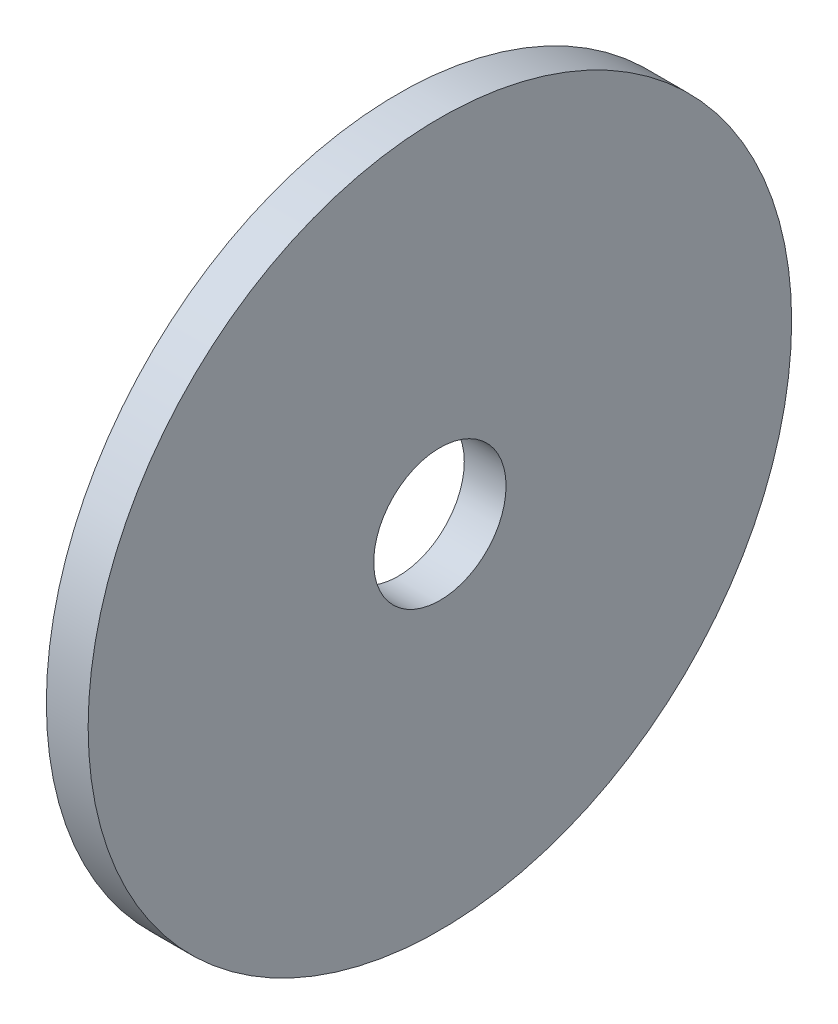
SolidWorks part; units mm, degrees
ref_plane "LAT. ESQUERDO" through (0, 0, 0) normal (0, 0, 1) x (1, 0, 0)
ref_plane "SUPERIOR" through (0, 0, 0) normal (0, 1, 0) x (1, 0, 0)
ref_plane "FRONTAL" through (0, 0, 0) normal (1, 0, 0) x (0, 0, -1)
sketch "Esboço1" plane through (0, 0, 0) normal (1, 0, 0) x (0, 0, -1)
  circle A0 centre (0, 0) radius 25.25
  circle A1 centre (0, 0) radius 4.75
  dimension "D1" = 50.5
  dimension "D2" = 9.5
sheet metal parameters "Chapa metálica1" thickness 3 parameters "D1"=0.1
base flange "Flange-base1" sketch "Esboço1" thickness 3 reverse thickness direction no parameters "D1"=0.1
flat pattern "Padrão-Plano1"
sketch "Curva-Linhas1" plane through (0, 0, 0) normal (0, 1, 0) x (1, 0, 0)
sketch3d "Caixa delimitadora1" [suppressed]
  line L0 (44.7991, -44.9008, 0) -> (44.9007, 44.7992, 0) construction
  line L1 (-44.9007, -44.7992, 0) -> (-44.7991, 44.9008, 0) construction
  line L2 (44.7991, -44.9008, 0) -> (-44.9007, -44.7992, 0) construction
  line L3 (44.9007, 44.7992, 0) -> (-44.7991, 44.9008, 0) construction
